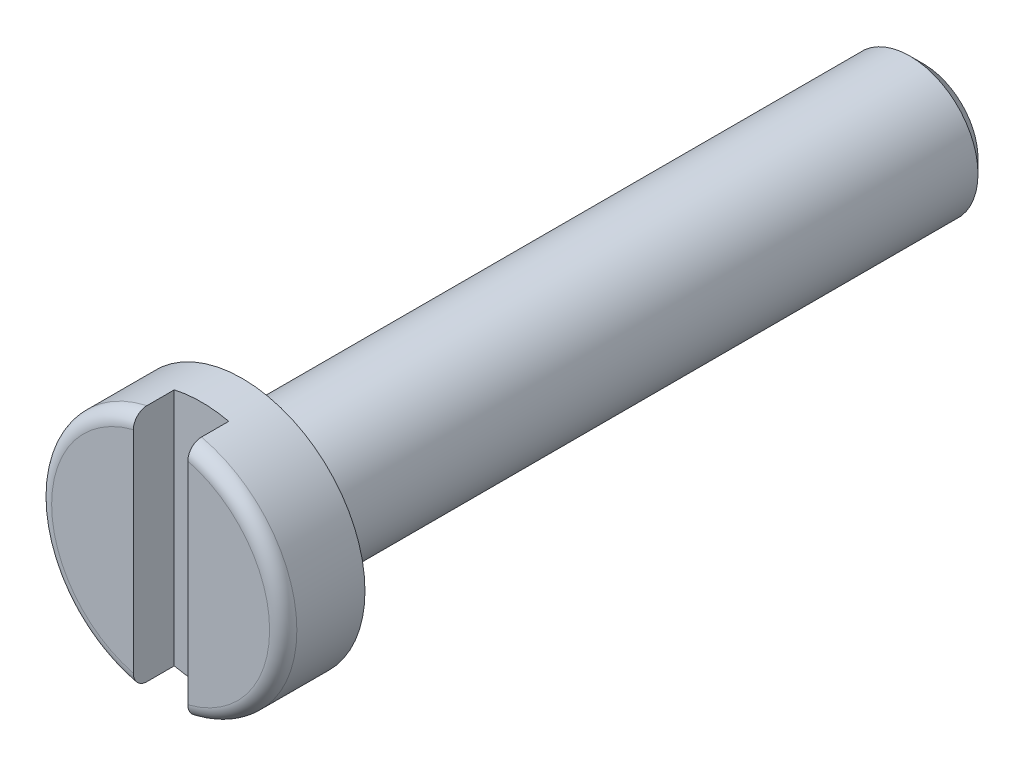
SolidWorks part; units mm, degrees
ref_plane "Plan de face" through (0, 0, 0) normal (0, 0, 1) x (1, 0, 0)
ref_plane "Plan de dessus" through (0, 0, 0) normal (0, 1, 0) x (1, 0, 0)
ref_plane "Plan de droite" through (0, 0, 0) normal (1, 0, 0) x (0, 0, -1)
sketch "Esquisse1" plane through (0, 0, 0) normal (0, 0, 1) x (1, 0, 0)
  circle A0 centre (0, 0) radius 4.5
  dimension "D1" = 9
extrude "Boss.-Extru.1" add sketch "Esquisse1" along normal blind 3
sketch "Esquisse2" plane through (0, 0, 0) normal (0, 0, -1) x (-1, 0, 0)
  circle A0 centre (0, 0) radius 2.5
  dimension "D1" = 5
extrude "Boss.-Extru.2" add sketch "Esquisse2" along normal blind 25
chamfer "Chanfrein1" distance 0.5 angle 45 1 edges at (-2.5, 0, -25)
fillet "Congé1" radius 0.5 1 edges at (4.5, 0, 3)
sketch "Esquisse3" plane through (0, 0, 3) normal (0, 0, 1) x (1, 0, 0)
  line L1 (-1, 4.8447) -> (1, 4.8447)
  line L2 (-1, 4.8447) -> (-1, -5.0946)
  line L3 (-1, -5.0946) -> (1, -5.0946)
  line L4 (1, 4.8447) -> (1, -5.0946)
  dimension "D1" = 1
  dimension "D2" = 2
extrude "Enlèv. mat.-Extru.1" cut sketch "Esquisse3" against normal blind 1.5
